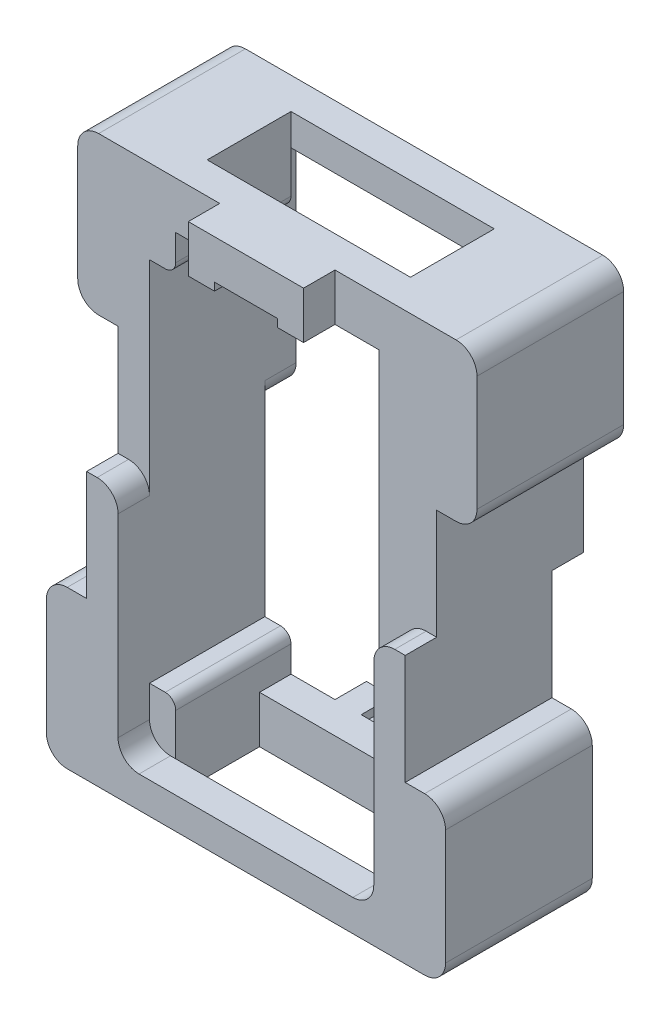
SolidWorks part; units mm, degrees
ref_plane "Front Plane" through (0, 0, 0) normal (0, 0, 1) x (1, 0, 0)
ref_plane "Top Plane" through (0, 0, 0) normal (0, 1, 0) x (1, 0, 0)
ref_plane "Right Plane" through (0, 0, 0) normal (1, 0, 0) x (0, 0, -1)
sketch "values-params_print" plane through (0, 0, 0) normal (0, 0, 1) x (1, 0, 0)
  line L0 (0, 0) -> (0.7, 0) construction
  line L1 (0, -5.2349) -> (3, -5.2349) construction
  line L2 (0, -10.104) -> (4, -10.104) construction
  line L4 (0, -19.837) -> (0.15, -19.837) construction
  line L5 (0, -24.2596) -> (0.35, -24.2596) construction
  line L6 (0, -28.606) -> (3.175, -28.606) construction
  line L7 (0, -33.0286) -> (9.5, -33.0286) construction
  line L8 (0, -37.6038) -> (2.4, -37.6038) construction
  line L9 (0, -43.1661) -> (6.35, -43.1661) construction
  dimension "width destroy" = 0.7
  dimension "width keep" = 3
  dimension "width tab" = 4
  dimension "print fit" = 0.15
  dimension "print free" = 0.35
  dimension "pin diameter" = 3.175
  dimension "pulley diameter" = 9.5
  dimension "pulley thickness" = 2.4
  dimension "base pin diameter" = 6.35
inserted part "params_print"
sketch "Body" plane through (0, 0, 0) normal (0, 0, 1) x (1, 0, 0)
  line L0 (0, 22.5) -> (0, -22.5) construction
  line L1 (-12.2, -22.5) -> (12.2, -22.5) construction
  line L2 (-12.2, -22.5) -> (-12.2, 22.5) construction
  line L3 (-12.2, 22.5) -> (12.2, 22.5) construction
  line L4 (12.2, -22.5) -> (12.2, 22.5) construction
  line L5 (-12.2, 0) -> (12.2, 0) construction
  line L6 (0, 22.5) -> (0, 25.5) construction
  line L7 (-9.7, 21) -> (9.7, 21)
  line L8 (-9.7, 21) -> (-9.7, -21)
  line L9 (-9.7, -21) -> (9.7, -21)
  line L10 (9.7, 21) -> (9.7, -21)
  line L11 (-15.2, 25.5) -> (15.2, 25.5)
  line L12 (-15.2, 25.5) -> (-15.2, -25.5)
  line L13 (-15.2, -25.5) -> (15.2, -25.5)
  line L14 (15.2, 25.5) -> (15.2, -25.5)
  line L15 (-12.2, 0) -> (-15.2, 0) construction
  circle A0 centre (0, 12.5) radius 8.5 construction
  dimension "D3" = 10
  dimension "D4" = 17
  dimension "DynWidth" = 24.4
  dimension "DynHeight" = 45
  dimension "D5" = 2.5
  dimension "D6" = 3
extrude "Main Body" add sketch "Body" along normal mid plane 11
sketch "Sketch2" plane through (0, 0, 5.5) normal (0, 0, 1) x (1, 0, 0)
  line L0 (-15.2, 0) -> (15.2, 0) construction
  line L1 (-15.2, 25.5) -> (-15.2, -25.5) construction
  line L2 (15.2, -25.5) -> (15.2, 25.5) construction
  line L3 (0, 25.5) -> (0, -25.5) construction
  line L4 (15.2, 25.5) -> (-15.2, 25.5) construction
  line L5 (-15.2, -25.5) -> (15.2, -25.5) construction
  line L6 (-12.2, 0) -> (-15.2, 0)
  line L7 (-15.2, 0) -> (-15.2, -25.5)
  line L8 (-12.2, 0) -> (-12.2, -22.5)
  line L9 (-12.2, -22.5) -> (12.2, -22.5)
  line L10 (12.2, 0) -> (12.2, -22.5)
  line L11 (-15.2, -25.5) -> (15.2, -25.5)
  line L12 (15.2, -25.5) -> (15.2, 0)
  line L13 (15.2, 0) -> (12.2, 0)
  line L14 (-15.2, 22.5) -> (15.2, 22.5) construction
  line L15 (-5.5, 25.5) -> (5.5, 25.5)
  line L16 (-5.5, 25.5) -> (-5.5, 21)
  line L17 (9.7, 21) -> (-9.7, 21) construction
  line L18 (-5.5, 21) -> (-3, 21)
  line L19 (-3, 21) -> (-3, 21.75)
  line L20 (-3, 21.75) -> (3, 21.75)
  line L21 (3, 21.75) -> (3, 21)
  line L22 (3, 21) -> (5.5, 21)
  line L23 (5.5, 21) -> (5.5, 25.5)
  circle A0 centre (0, 12.5) radius 8.5 construction
  dimension "D4" = 17
  dimension "D5" = 10
  dimension "D1" = 22.5
  dimension "D2" = 24.4
  dimension "D3" = 11
  dimension "D6" = 6
  dimension "D7" = 21.75
extrude "Clamp Walls 1" add sketch "Sketch2" along normal blind 3 and the other way up to surface
sketch "Sketch3" plane through (0, 0, -5.5) normal (0, 0, -1) x (-1, 0, 0)
  line L0 (0, -25.5) -> (0, 25.5) construction
  line L1 (15.2, -25.5) -> (-15.2, -25.5) construction
  line L2 (-15.2, 25.5) -> (15.2, 25.5) construction
  line L3 (15.2, 0) -> (-15.2, 0) construction
  line L4 (15.2, 25.5) -> (15.2, -25.5) construction
  line L5 (-15.2, -25.5) -> (-15.2, 25.5) construction
  line L6 (15.2, 0) -> (15.2, 25.5)
  line L7 (15.2, 25.5) -> (-15.2, 25.5)
  line L8 (-15.2, 25.5) -> (-15.2, 0)
  line L9 (-15.2, 0) -> (-12.2, 0)
  line L10 (-12.2, 0) -> (-12.2, 22.5)
  line L11 (-12.2, 22.5) -> (12.2, 22.5)
  line L12 (12.2, 22.5) -> (12.2, 0)
  line L13 (12.2, 0) -> (15.2, 0)
  line L14 (5.5, -25.5) -> (5.5, -21)
  line L15 (9.7, -21) -> (-9.7, -21) construction
  line L16 (5.5, -21) -> (3, -21)
  line L17 (3, -21) -> (3, -21.75)
  line L18 (3, -21.75) -> (-3, -21.75)
  line L19 (-3, -21.75) -> (-3, -21)
  line L20 (-3, -21) -> (-5.5, -21)
  line L21 (-5.5, -21) -> (-5.5, -25.5)
  line L22 (-5.5, -25.5) -> (5.5, -25.5)
  dimension "D1" = 24.4
  dimension "D2" = 22.5
  dimension "D3" = 11
  dimension "D4" = 6
  dimension "D5" = 21.75
extrude "Clamp Walls 2" add sketch "Sketch3" along normal blind 3
sketch "Sketch7" plane through (-15.2, 0, 0) normal (-1, 0, 0) x (0, 0, 1)
  line L0 (-5.5, 0) -> (-5.5, -25.5) construction
  line L1 (8.5, -25.5) -> (-5.5, -25.5)
  line L2 (8.5, -25.5) -> (8.5, -10.5)
  line L3 (8.5, -10.5) -> (-5.5, -10.5)
  line L4 (-5.5, -25.5) -> (-5.5, -10.5)
  line L6 (5.5, 25.5) -> (5.5, 0) construction
  line L7 (-8.5, 25.5) -> (5.5, 25.5)
  line L8 (-8.5, 25.5) -> (-8.5, 10.5)
  line L9 (-8.5, 10.5) -> (5.5, 10.5)
  line L10 (8.5, 0) -> (-8.5, 0) construction
  line L11 (5.5, 25.5) -> (5.5, 10.5)
  dimension "D1" = 15
extrude "Standoff 1" add sketch "Sketch7" along normal blind 3.85
sketch "Sketch8" plane through (15.2, 0, 0) normal (1, 0, 0) x (0, 0, -1)
  line L0 (-8.5, -25.5) -> (-8.5, 0) construction
  line L1 (5.5, -25.5) -> (-8.5, -25.5)
  line L2 (5.5, -25.5) -> (5.5, -10.5)
  line L3 (5.5, -10.5) -> (-8.5, -10.5)
  line L4 (-8.5, -25.5) -> (-8.5, -10.5)
  line L5 (-5.5, 0) -> (-5.5, 25.5) construction
  line L6 (8.5, 25.5) -> (-5.5, 25.5)
  line L7 (8.5, 25.5) -> (8.5, 10.5)
  line L8 (8.5, 10.5) -> (-5.5, 10.5)
  line L9 (-5.5, 25.5) -> (-5.5, 10.5)
  line L10 (8.5, 25.5) -> (8.5, 10.5) construction
extrude "Standoff 2" add sketch "Sketch8" along normal blind 3.85
fillet "Contouring" radius 2 16 edges at (-19.05, -10.5, 1.5) (-19.05, 10.5, -1.5) (19.05, 10.5, -1.5) (19.05, -10.5, 1.5) (-12.2, 0, 7) (12.2, 0, 7) (12.2, 0, -7) (-12.2, 0, -7) (12.2, 22.5, -7) (-12.2, 22.5, -7) (-12.2, -22.5, 7) (12.2, -22.5, 7) (-19.05, -25.5, 1.5) (-19.05, 25.5, -1.5) (19.05, 25.5, -1.5) (19.05, -25.5, 1.5)
sketch "Sketch11" plane through (0, 25.5, 0) normal (0, 1, 0) x (1, 0, 0)
  line L0 (17.05, 1.5) -> (-19.05, 1.5) construction
  line L4 (-9.7, -5.5) -> (-9.7, 5.5) construction
  line L5 (9.7, -5.5) -> (9.7, 5.5) construction
  line L6 (17.05, -5.5) -> (17.05, 8.5) construction
  line L7 (-9.7, -2.5) -> (-9.7, 5.5)
  line L8 (9.7, -2.5) -> (9.7, 5.5)
  line L9 (-19.05, -5.5) -> (-19.05, 8.5) construction
  line L14 (17.05, -5.5) -> (5.5, -5.5) construction
  line L15 (9.7, -2.5) -> (-9.7, -2.5)
  line L17 (9.7, 5.5) -> (-9.7, 5.5)
  dimension "D1" = 3
extrude "Ventilation 1" cut sketch "Sketch11" against normal up to surface (4.5 mm away)
sketch "Sketch12" plane through (0, -25.5, 0) normal (0, -1, 0) x (1, 0, 0)
  line L0 (-16.4, 1.5) -> (17.05, 1.5) construction
  line L2 (17.05, -5.5) -> (17.05, 8.5) construction
  line L7 (-9.7, 5.5) -> (9.7, 5.5)
  line L8 (-9.7, 5.5) -> (-9.7, -2.5)
  line L9 (-9.7, -2.5) -> (9.7, -2.5)
  line L10 (9.7, 5.5) -> (9.7, -2.5)
  line L11 (-9.7, -5.5) -> (-9.7, 2.5) construction
  line L12 (-9.7, 2.5) -> (9.7, 2.5) construction
extrude "Ventilation 2" cut sketch "Sketch12" against normal up to surface (4.5 mm away)
sketch "Sketch13" plane through (0, 0, 5.5) normal (0, 0, 1) x (1, 0, 0)
  line L0 (-9.7, 21) -> (-9.7, -22.5) construction
  line L1 (-9.7, -17.5) -> (-12.2, -17.5)
  line L2 (-9.7, -17.5) -> (-9.7, 17.5)
  line L3 (-9.7, 17.5) -> (-12.2, 17.5)
  line L4 (-12.2, -17.5) -> (-12.2, 17.5)
  line L5 (-12.2, -20.5) -> (-12.2, -2) construction
  line L6 (0, 0) -> (-9.7, 0) construction
  line L7 (9.7, -22.5) -> (-9.7, -22.5) construction
  dimension "D1" = 5
extrude "MX Cap Clearance" cut sketch "Sketch13" against normal up to surface (11 mm away)
fillet "Contouring - Inner" radius 1 2 edges at (-9.7, -17.5, 0) (-9.7, 17.5, 0)
ref_point "Ref Center"
equation "\"D6@Body\" = \"width keep@values@params_print.SLDPRT\""
equation "\"D1@Sketch2\"=\"DynHeight@Body\"/2"
equation "\"D2@Sketch2\"=\"DynWidth@Body\""
equation "\"D7@Sketch2\"=\"DynHeight@Body\"/2-0.75"
equation "\"D1@Sketch3\"=\"DynWidth@Body\""
equation "\"D2@Sketch3\"=\"DynHeight@Body\"/2"
equation "\"D5@Sketch3\"=\"DynHeight@Body\"/2-0.75"
equation "\"D1@Clamp Walls 1\" = \"width keep@values@params_print.SLDPRT\""
equation "\"D1@Clamp Walls 2\" = \"width keep@values@params_print.SLDPRT\""
equation "\"D1@Standoff 2\"=5.6 +1.25 - \"width keep@values@params_print.SLDPRT\""
equation "\"D1@Sketch11\" = \"width keep@values@params_print.SLDPRT\""
equation "\"D1@Standoff 1\"=5.6 + 1.25 - \"width keep@values@params_print.SLDPRT\""
